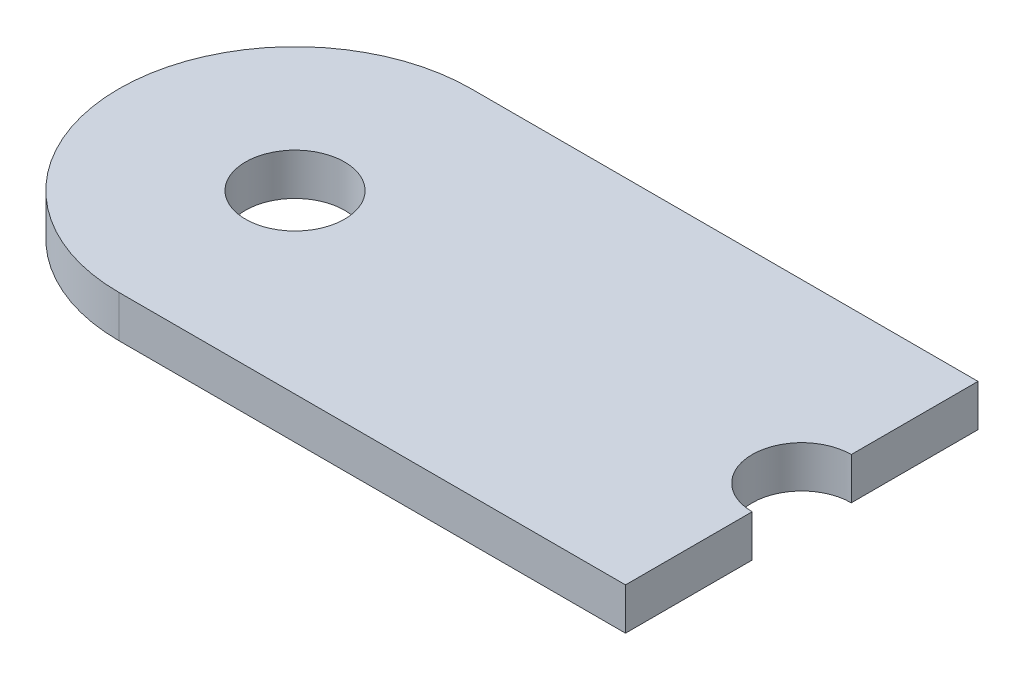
SolidWorks part; units mm, degrees
ref_plane "Front Plane" through (0, 0, 0) normal (0, 0, 1) x (1, 0, 0)
ref_plane "Top Plane" through (0, 0, 0) normal (0, 1, 0) x (1, 0, 0)
ref_plane "Right Plane" through (0, 0, 0) normal (1, 0, 0) x (0, 0, -1)
sketch "Sketch1" plane through (0, 0, 0) normal (0, 1, 0) x (1, 0, 0)
  line L0 (-11.5, 0) -> (11.5, 0) construction
  line L1 (-11.5, 8) -> (11.5, 8)
  line L2 (-11.5, -8) -> (11.5, -8)
  line L3 (11.5, 8) -> (11.5, -8)
  line L4 (-11.5, 8) -> (-11.5, -8) construction
  arc A0 (-11.5, 8) -> (-11.5, -8) centre (-11.5, 0) ccw
  arc A1 (11.5, -8) -> (11.5, 8) centre (11.5, 0) ccw
  circle A2 centre (-11.5, 0) radius 2.25
  circle A3 centre (11.5, 0) radius 2.25
  point P2 (0, 0)
  dimension "D1" = 8
  dimension "D3" = 4.5
  dimension "D2" = 23
extrude "Boss-Extrude1" add sketch "Sketch1" along normal mid plane 1.9 contours A3 L3 L1 A0 L2 A2
